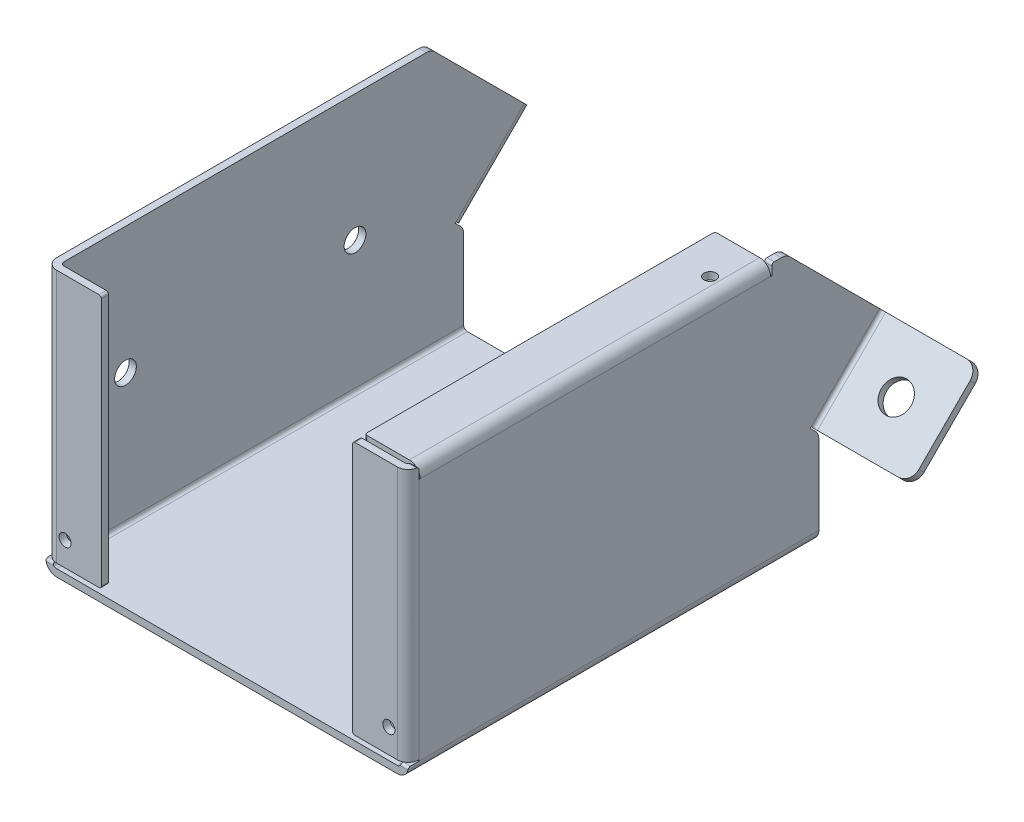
SolidWorks part; units mm, degrees
ref_plane "Plan de face" through (0, 0, 0) normal (0, 0, 1) x (1, 0, 0)
ref_plane "Plan de dessus" through (0, 0, 0) normal (0, 1, 0) x (1, 0, 0)
ref_plane "Plan de droite" through (0, 0, 0) normal (1, 0, 0) x (0, 0, -1)
ref_plane "Plan1" through (75, 0, 0) normal (1, 0, 0) x (0, 0, -1)
sketch "Esquisse1" plane through (75, 0, 0) normal (1, 0, 0) x (0, 0, -1)
  line L0 (156.5685, 110) -> (156.5685, 39.2929)
  line L1 (156.5685, 39.2929) -> (162.9289, 39.2929)
  line L2 (162.9289, 39.2929) -> (195.1023, 71.4663)
  line L3 (195.1023, 71.4663) -> (156.5685, 110)
extrude "Boss.-Extru.1" add sketch "Esquisse1" against normal blind 150
sketch "Esquisse2" plane through (0, 39.2929, 0) normal (0, -1, 0) x (1, 0, 0)
  line L0 (75, -156.5685) -> (75, -162.9289)
  line L1 (75, -162.9289) -> (-75, -162.9289)
  line L2 (-75, -162.9289) -> (-75, -156.5685)
  line L3 (-75, -156.5685) -> (75, -156.5685)
extrude "Boss.-Extru.2" add sketch "Esquisse2" along normal blind 39.2929
ref_plane "Plan2" through (72, 0, 0) normal (1, 0, 0) x (0, 0, -1)
sketch "Esquisse3" plane through (72, 0, 0) normal (1, 0, 0) x (0, 0, -1)
  line L0 (156.5685, 110) -> (156.5685, 3)
  line L1 (156.5685, 3) -> (162.9289, 3)
  line L2 (162.9289, 3) -> (162.9289, 39.2929)
  line L3 (162.9289, 39.2929) -> (195.1023, 71.4663)
  line L4 (195.1023, 71.4663) -> (156.5685, 110)
extrude "Enlèv. mat.-Extru.1" cut sketch "Esquisse3" against normal blind 144
sketch "Esquisse4" plane through (0, 0, -156.5685) normal (0, 0, 1) x (1, 0, 0)
  line L0 (-72, 3) -> (72, 3)
  line L1 (72, 3) -> (72, 110)
  line L2 (72, 110) -> (75, 110)
  line L3 (75, 110) -> (75, 0)
  line L4 (75, 0) -> (-75, 0)
  line L5 (-75, 0) -> (-75, 110)
  line L6 (-75, 110) -> (-72, 110)
  line L7 (-72, 110) -> (-72, 3)
extrude "Boss.-Extru.3" add sketch "Esquisse4" along normal blind 156.5685
sketch "Esquisse5" plane through (0, 0, -162.9289) normal (0, 0, -1) x (-1, 0, 0)
  line L0 (72, 3) -> (72, 39.2929)
  line L1 (72, 39.2929) -> (75, 39.2929)
  line L2 (75, 39.2929) -> (75, 0)
  line L3 (75, 0) -> (-75, 0)
  line L4 (-75, 0) -> (-75, 39.2929)
  line L5 (-75, 39.2929) -> (-72, 39.2929)
  line L6 (-72, 39.2929) -> (-72, 3)
  line L7 (-72, 3) -> (72, 3)
extrude "Boss.-Extru.4" add sketch "Esquisse5" along normal blind 7.0711
sketch "Esquisse6" plane through (0, -61.818, -61.818) normal (0, -0.7071, -0.7071) x (-1, 0, 0)
  line L0 (75, 148.4924) -> (72, 148.4924)
  line L1 (72, 148.4924) -> (72, 188.4924)
  line L2 (72, 188.4924) -> (75, 188.4924)
  line L3 (75, 188.4924) -> (75, 148.4924)
extrude "Boss.-Extru.5" add sketch "Esquisse6" along normal blind 4.5
sketch "Esquisse7" plane through (-75, 0, 0) normal (-1, 0, 0) x (0, 0, 1)
  line L0 (-170, 40) -> (-198.2843, 68.2843)
  line L1 (-198.2843, 68.2843) -> (-196.163, 70.4056)
  line L2 (-196.163, 70.4056) -> (-167.8787, 42.1213)
  line L3 (-167.8787, 42.1213) -> (-170, 40)
extrude "Boss.-Extru.6" add sketch "Esquisse7" along normal blind 40
sketch "Esquisse8" plane through (-75, 0, 0) normal (-1, 0, 0) x (0, 0, 1)
  line L0 (0, 4.5) -> (0, 5)
  line L1 (0, 5) -> (-4.5, 5)
  line L2 (-4.5, 5) -> (-4.5, 4.5)
  line L3 (-4.5, 4.5) -> (0, 4.5)
extrude "Enlèv. mat.-Extru.2" cut sketch "Esquisse8" against normal up to next
sketch "Esquisse9" plane through (-72, 0, 0) normal (1, 0, 0) x (0, 0, -1)
  line L0 (0, 5) -> (0, 110)
  line L1 (0, 110) -> (3, 110)
  line L2 (3, 110) -> (3, 5)
  line L3 (3, 5) -> (0, 5)
extrude "Boss.-Extru.7" add sketch "Esquisse9" along normal blind 12
sketch "Esquisse10" plane through (0, -61.818, -61.818) normal (0, -0.7071, -0.7071) x (-1, 0, 0)
  line L0 (-75, 188.4924) -> (-72, 188.4924)
  line L1 (-72, 188.4924) -> (-72, 148.4924)
  line L2 (-72, 148.4924) -> (-75, 148.4924)
  line L3 (-75, 148.4924) -> (-75, 188.4924)
extrude "Boss.-Extru.8" add sketch "Esquisse10" along normal blind 4.5
sketch "Esquisse11" plane through (75, 0, 0) normal (1, 0, 0) x (0, 0, -1)
  line L0 (198.2843, 68.2843) -> (170, 40)
  line L1 (170, 40) -> (167.8787, 42.1213)
  line L2 (167.8787, 42.1213) -> (196.163, 70.4056)
  line L3 (196.163, 70.4056) -> (198.2843, 68.2843)
extrude "Boss.-Extru.9" add sketch "Esquisse11" along normal blind 40
sketch "Esquisse12" plane through (75, 0, 0) normal (1, 0, 0) x (0, 0, -1)
  line L0 (0, 5) -> (0, 4.5)
  line L1 (0, 4.5) -> (4.5, 4.5)
  line L2 (4.5, 4.5) -> (4.5, 5)
  line L3 (4.5, 5) -> (0, 5)
extrude "Enlèv. mat.-Extru.3" cut sketch "Esquisse12" against normal through all
sketch "Esquisse13" plane through (72, 0, 0) normal (-1, 0, 0) x (0, 0, 1)
  line L0 (0, 110) -> (0, 5)
  line L1 (0, 5) -> (-3, 5)
  line L2 (-3, 5) -> (-3, 110)
  line L3 (-3, 110) -> (0, 110)
extrude "Boss.-Extru.10" add sketch "Esquisse13" along normal blind 12
sketch "Esquisse14" plane through (75, 0, 0) normal (1, 0, 0) x (0, 0, -1)
  line L0 (5, 110) -> (4.5, 110)
  line L1 (4.5, 110) -> (4.5, 105.5)
  line L2 (4.5, 105.5) -> (5, 105.5)
  line L3 (5, 105.5) -> (5, 110)
extrude "Enlèv. mat.-Extru.4" cut sketch "Esquisse14" against normal up to next
sketch "Esquisse15" plane through (75, 0, 0) normal (1, 0, 0) x (0, 0, -1)
  line L0 (150.5, 110) -> (150, 110)
  line L1 (150, 110) -> (150, 105.5)
  line L2 (150, 105.5) -> (150.5, 105.5)
  line L3 (150.5, 105.5) -> (150.5, 110)
extrude "Enlèv. mat.-Extru.5" cut sketch "Esquisse15" against normal up to next
sketch "Esquisse16" plane through (72, 0, 0) normal (-1, 0, 0) x (0, 0, 1)
  line L0 (-150, 110) -> (-5, 110)
  line L1 (-5, 110) -> (-5, 107)
  line L2 (-5, 107) -> (-150, 107)
  line L3 (-150, 107) -> (-150, 110)
extrude "Boss.-Extru.11" add sketch "Esquisse16" along normal blind 12
draft "Dépouille1" type of draft neutral plane draft angle 45 faces to draft 2 parameters "D1"=45
hole_wizard "Diamètre du perçage Ø9.0 (9)1" positions "Esquisse18" profile "Esquisse17" hole size "Ø9.0" standard "Ansi Metric"
sketch "Esquisse18" plane through (-75, 0, 0) normal (-1, 0, 0) x (0, 0, 1)
  point P0 (-30, 57.5)
  point P1 (-125, 57.5)
sketch "Esquisse17" plane through (-75, 57.5, -30) normal (0, 1, 0) x (0, 0, 1)
  line L0 (0, 0) -> (0, 3)
  line L1 (0, 3) -> (4.5, 3)
  line L2 (4.5, 3) -> (4.5, 0)
  line L5 (4.5, 0) -> (0, 0)
  line L11 (0, -6.35) -> (0, 107.95) construction
  dimension "Diamètre du perçage jusqu'au prochain" = 9
  dimension "Profondeur du perçage jusqu'au prochain" = 3
hole_wizard "Diamètre du perçage Ø5.0 (5)1" positions "Esquisse20" profile "Esquisse19" hole size "Ø5.0" standard "Ansi Metric"
sketch "Esquisse20" plane through (0, 0, 0) normal (0, 0, 1) x (1, 0, 0)
  point P0 (-67, 15)
sketch "Esquisse19" plane through (-67, 15, 0) normal (1, 0, 0) x (0, -1, 0)
  line L0 (0, 0) -> (0, 198.2843)
  line L1 (0, 198.2843) -> (2.5, 198.2843)
  line L2 (2.5, 198.2843) -> (2.5, 0)
  line L5 (2.5, 0) -> (0, 0)
  line L11 (0, -6.35) -> (0, 107.95) construction
  dimension "Diamètre du perçage jusqu'au prochain" = 5
  dimension "Profondeur du perçage jusqu'au prochain" = 198.2843
hole_wizard "Perçage1" positions "Esquisse22" profile "Esquisse21" legacy
sketch "Esquisse22" plane through (0, -62.8787, -62.8787) normal (0, 0.7071, 0.7071) x (1, 0, 0)
  point P0 (-95, 168.4924)
sketch "Esquisse21" plane through (-95, 56.2635, -182.0208) normal (1, 0, 0) x (0, -0.7071, 0.7071)
  line L0 (0, 0) -> (0, 51.2843)
  line L1 (0, 51.2843) -> (6.15, 51.2843)
  line L2 (6.15, 51.2843) -> (6.15, 0)
  line L3 (6.15, 0) -> (0, 0)
  line L4 (0, 110) -> (0, -10) construction
  dimension "Diamètre" = 12.3
  dimension "Profondeur" = 51.2843
hole_wizard "Diamètre du perçage Ø5.0 (5)2" positions "Esquisse24" profile "Esquisse23" hole size "Ø5.0" standard "Ansi Metric"
sketch "Esquisse24" plane through (0, 110, 0) normal (0, 1, 0) x (1, 0, 0)
  point P0 (67, 133)
sketch "Esquisse23" plane through (67, 110, -133) normal (1, 0, 0) x (0, 0, 1)
  line L0 (0, 0) -> (0, 3)
  line L1 (0, 3) -> (2.5, 3)
  line L2 (2.5, 3) -> (2.5, 0)
  line L5 (2.5, 0) -> (0, 0)
  line L11 (0, -6.35) -> (0, 107.95) construction
  dimension "Diamètre du perçage jusqu'au prochain" = 5
  dimension "Profondeur du perçage jusqu'au prochain" = 3
hole_wizard "Diamètre du perçage Ø5.0 (5)3" positions "Esquisse26" profile "Esquisse25" hole size "Ø5.0" standard "Ansi Metric"
sketch "Esquisse26" plane through (0, 0, -3) normal (0, 0, -1) x (-1, 0, 0)
  point P0 (-67, 15)
sketch "Esquisse25" plane through (67, 15, -3) normal (1, 0, 0) x (0, 1, 0)
  line L0 (0, 0) -> (0, 3)
  line L1 (0, 3) -> (2.5, 3)
  line L2 (2.5, 3) -> (2.5, 0)
  line L5 (2.5, 0) -> (0, 0)
  line L11 (0, -6.35) -> (0, 107.95) construction
  dimension "Diamètre du perçage jusqu'au prochain" = 5
  dimension "Profondeur du perçage jusqu'au prochain" = 3
hole_wizard "Perçage2" positions "Esquisse28" profile "Esquisse27" legacy
sketch "Esquisse28" plane through (0, -65, -65) normal (0, -0.7071, -0.7071) x (-1, 0, 0)
  point P0 (-95, 168.4924)
sketch "Esquisse27" plane through (95, 54.1421, -184.1421) normal (1, 0, 0) x (0, 0.7071, -0.7071)
  line L0 (0, 0) -> (0, 169.7056)
  line L1 (0, 169.7056) -> (6.15, 169.7056)
  line L2 (6.15, 169.7056) -> (6.15, 0)
  line L3 (6.15, 0) -> (0, 0)
  line L4 (0, 110) -> (0, -10) construction
  dimension "Diamètre" = 12.3
  dimension "Profondeur" = 169.7056
fillet "Congé1" radius 1.5 7 edges at (72, 107, -77.5) (72, 3, -85) (-72, 3, -85) (-72, 57.5, -3) (72, 57.5, -3)
fillet "Congé2" radius 1 4 edges at (73.5, 110, -4.5) (73.5, 4.5, 0) (73.5, 110, -150.5) (-73.5, 4.5, 0)
fillet "Congé3" radius 4.5 7 edges at (72, 54.1421, -184.1421) (-72, 54.1421, -184.1421) (75, 0, -85) (-75, 57.5, 0) (-75, 0, -85) (75, 110, -77.5) (75, 57.5, 0)
fillet "Congé4" radius 5 8 edges at (-73.5, 110, -156.5685) (-73.5, 39.2929, -170) (-115, 69.3449, -197.2236) (115, 41.0607, -168.9393) (73.5, 110, -156.5685) (-115, 41.0607, -168.9393) (115, 69.3449, -197.2236) (73.5, 39.2929, -170)
sketch "Esquisse29" plane through (0, 110, 0) normal (0, 1, 0) x (1, 0, 0)
  line L0 (67, 130.5) -> (67, 135.5)
  circle A0 centre (67, 133) radius 2.5 construction
sketch "Esquisse30" plane through (-72, 0, 0) normal (1, 0, 0) x (0, 0, -1)
  line L0 (25.5, 57.5) -> (34.5, 57.5)
  circle A0 centre (30, 57.5) radius 4.5 construction
sketch "Esquisse31" plane through (60, 0, 0) normal (-1, 0, 0) x (0, 0, 1)
  line L1 (-150, 107) -> (-5, 107)
  line L2 (-150, 107) -> (-150, 110)
  line L3 (-150, 110) -> (-5, 110)
  line L4 (-5, 107) -> (-5, 110)
  line L5 (0, 5) -> (-3, 5)
  line L6 (0, 5) -> (0, 110)
  line L7 (0, 110) -> (-3, 110)
  line L8 (-3, 5) -> (-3, 110)
extrude "Boss.-Extru.12" add sketch "Esquisse31" along normal blind 8
sketch "Esquisse32" plane through (-60, 0, 0) normal (1, 0, 0) x (0, 0, -1)
  line L1 (3, 5) -> (0, 5)
  line L2 (3, 5) -> (3, 110)
  line L3 (3, 110) -> (0, 110)
  line L4 (0, 5) -> (0, 110)
extrude "Boss.-Extru.13" add sketch "Esquisse32" along normal blind 8
fillet "Congé5" radius 1 6 edges at (52, 108.5, -150) (52, 108.5, -5) (52, 110, -1.5) (52, 5, -1.5) (-52, 5, -1.5) (-52, 110, -1.5)
